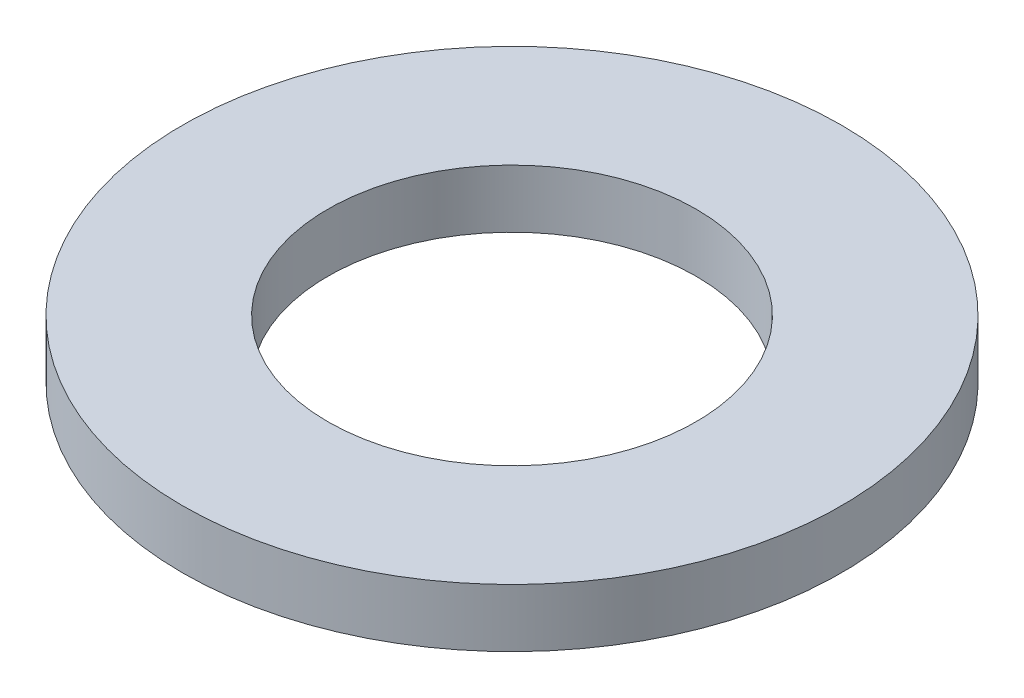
SolidWorks part; units mm, degrees
ref_plane "Front" through (0, 0, 0) normal (0, 0, 1) x (1, 0, 0)
ref_plane "Top" through (0, 0, 0) normal (0, 1, 0) x (1, 0, 0)
ref_plane "Right" through (0, 0, 0) normal (1, 0, 0) x (0, 0, -1)
sketch "Sketch1" plane through (0, 0, 0) normal (0, 1, 0) x (1, 0, 0)
  circle A0 centre (0, 0) radius 9.5
  circle A1 centre (0, 0) radius 17
extrude "Extrude1" add sketch "Sketch1" along normal blind 3
